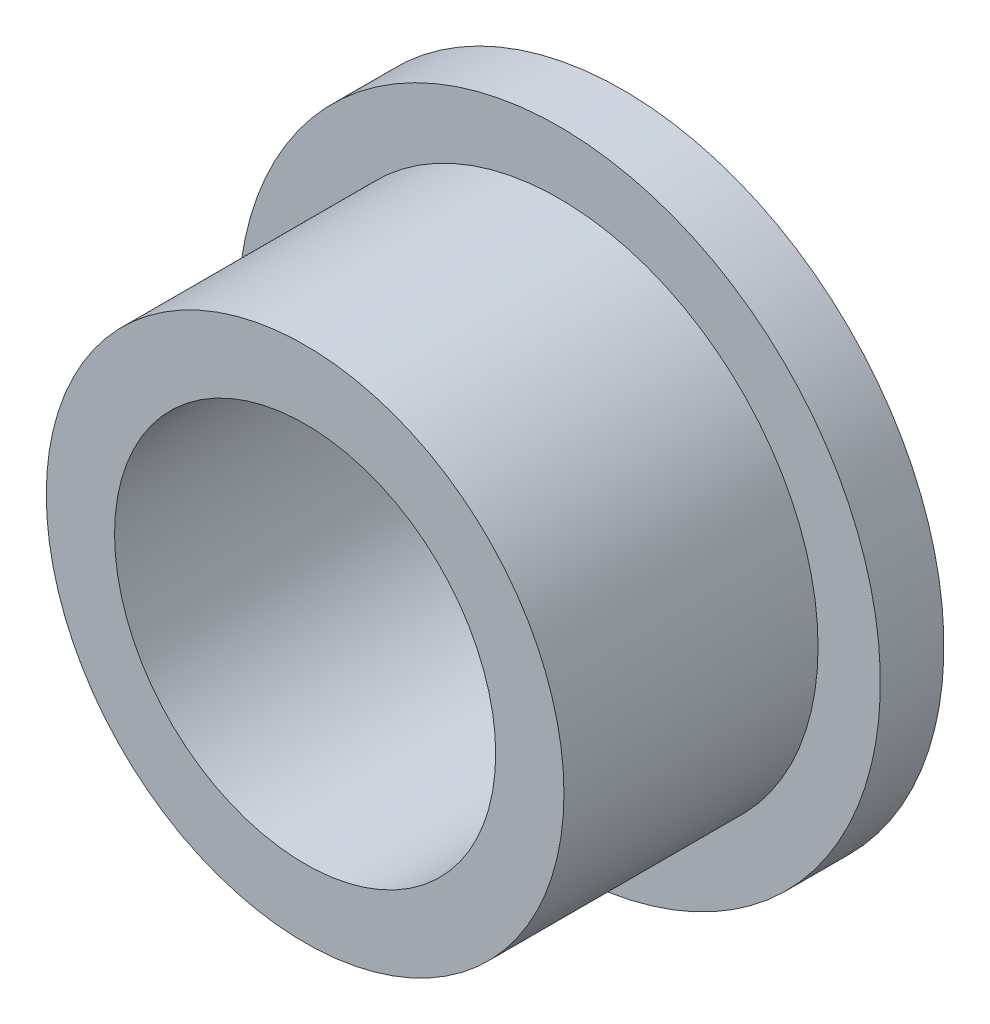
SolidWorks part; units mm, degrees
ref_plane "前视基准面" through (0, 0, 0) normal (0, 0, 1) x (1, 0, 0)
ref_plane "上视基准面" through (0, 0, 0) normal (0, 1, 0) x (1, 0, 0)
ref_plane "右视基准面" through (0, 0, 0) normal (1, 0, 0) x (0, 0, -1)
other "Configuration Table"
sketch "草图1" plane through (0, 0, 0) normal (0, 0, 1) x (1, 0, 0)
  circle A0 centre (0, 0) radius 4.075
  circle A1 centre (0, 0) radius 3
extrude "凸台-拉伸4" add sketch "草图1" along normal blind 5
sketch "草图7" plane through (0, 0, 0) normal (0, 0, -1) x (-1, 0, 0)
  circle A0 centre (0, 0) radius 5.0562
  circle A1 centre (0, 0) radius 4.075
extrude "凸台-拉伸5" add sketch "草图7" against normal blind 1
